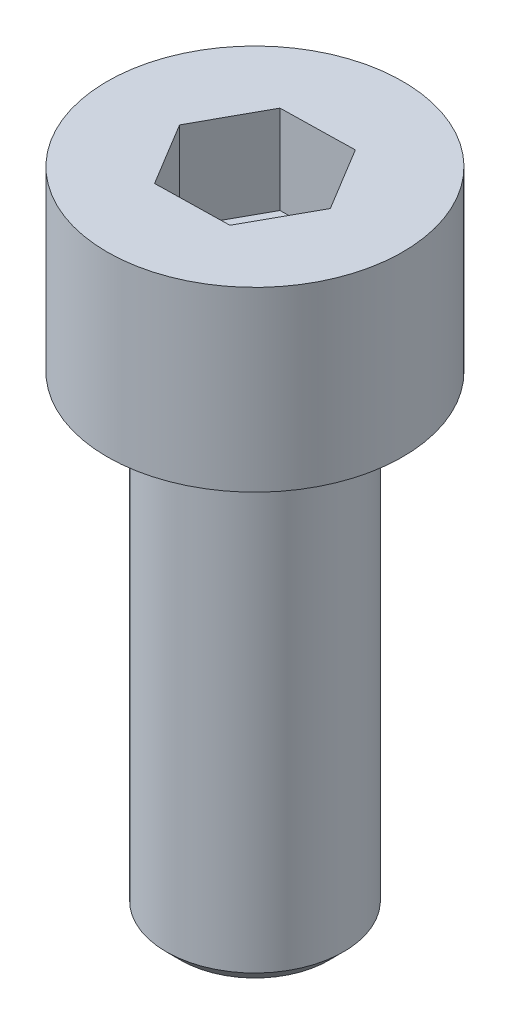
SolidWorks part; units mm, degrees
ref_plane "Plane1" through (0, 0, 0) normal (0, 0, 1) x (1, 0, 0)
ref_plane "Plane2" through (0, 0, 0) normal (0, 1, 0) x (1, 0, 0)
ref_plane "Plane3" through (0, 0, 0) normal (1, 0, 0) x (0, 0, -1)
sketch "Esquisse1" plane through (0, 0, 0) normal (0, 0, 1) x (1, 0, 0)
  line L0 (3, 0) -> (5, 0)
  line L1 (5, 0) -> (5, 6)
  line L2 (5, 6) -> (0, 6)
  line L3 (0, 6) -> (0, -16)
  line L4 (0, -16) -> (2.5, -16)
  line L5 (3, -15.5) -> (3, 0)
  line L6 (2.5, -16) -> (3, -15.5)
  line L7 (0, 7.5462) -> (0, -31.9443) construction
  dimension "D2" = 6
  dimension "l" = 16
  dimension "d" = 3
  dimension "D5" = 45
  dimension "D6" = 0.5
  dimension "a" = 5
revolve "Base-Révolution" add sketch "Esquisse1" angle 360 about L7
sketch "hexagon1" plane through (-1.2075, 6, -1.1025) normal (0, 1, 0) x (-1, 0, 0)
  line L0 (1.292, 1.1526) -> (-0.0012, 3.2922)
  line L1 (-0.0012, 3.2922) -> (-2.5007, 3.242)
  line L2 (-2.5007, 3.242) -> (-3.707, 1.0523)
  line L3 (-3.707, 1.0523) -> (-2.4138, -1.0872)
  line L4 (-2.4138, -1.0872) -> (0.0857, -1.0371)
  line L5 (0.0857, -1.0371) -> (1.292, 1.1526)
  circle A0 centre (-1.2075, 1.1025) radius 2.5 construction
  dimension "s1" = 5
extrude "Enlèv. mat.-Extru.1" cut sketch "hexagon1" against normal blind 3
equation "\"D2@Esquisse1\" = \"d@Esquisse1\"*2"
equation "\"D1@Enlèv. mat.-Extru.1\"=\"d@Esquisse1\""
